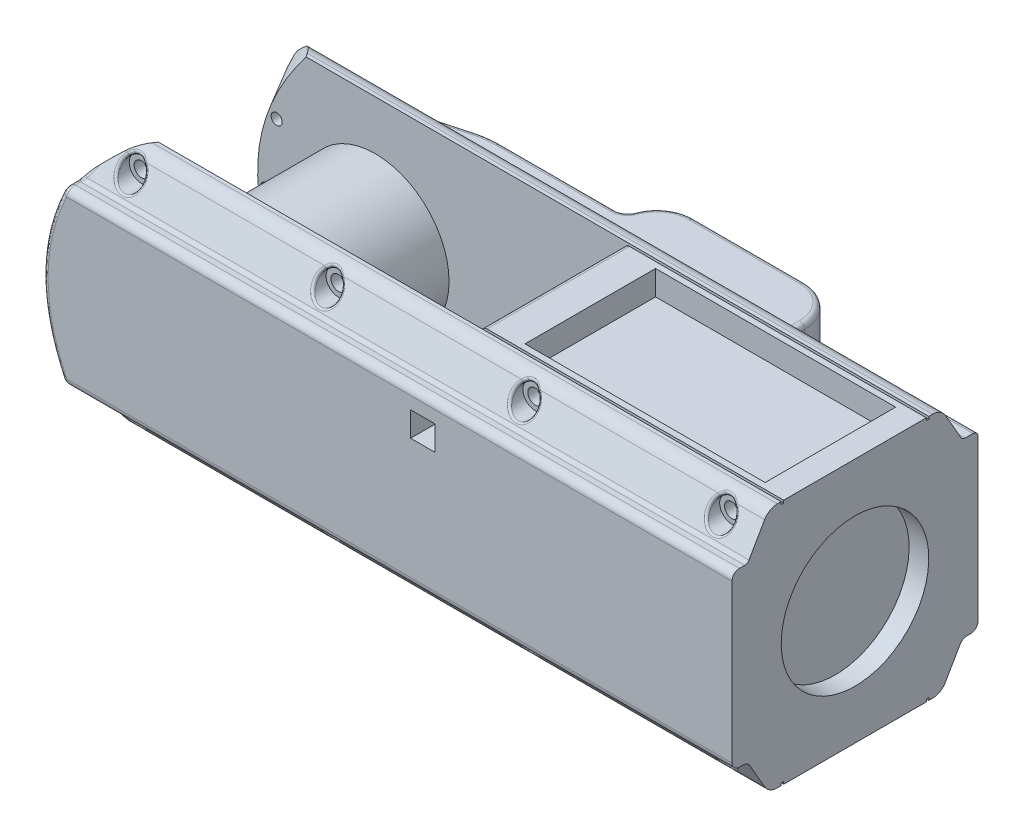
SolidWorks part; units mm, degrees
ref_plane "Płaszczyzna przednia" through (0, 0, 0) normal (0, 0, 1) x (1, 0, 0)
ref_plane "Płaszczyzna górna" through (0, 0, 0) normal (0, 1, 0) x (1, 0, 0)
ref_plane "Płaszczyzna prawa" through (0, 0, 0) normal (1, 0, 0) x (0, 0, -1)
sketch "Szkic1" plane through (0, 0, 0) normal (0, 0, 1) x (1, 0, 0)
  line L1 (-140, 50) -> (140, 50)
  line L2 (-140, 50) -> (-140, -50)
  line L3 (-140, -50) -> (140, -50)
  line L4 (140, 50) -> (140, -50)
  line L5 (-140, 50) -> (140, -50) construction
  line L6 (-140, -50) -> (140, 50) construction
  point P0 (0, 0)
  dimension "D1" = 100
  dimension "D2" = 280
extrude "Dodanie-wyciągnięcie1" add sketch "Szkic1" along normal blind 100
sketch "Szkic2" plane through (140, 0, 0) normal (1, 0, 0) x (0, 0, -1)
  line L0 (-100, 50) -> (0, -50) construction
  circle A0 centre (-50, 0) radius 30
extrude "Wytnij-wyciągnięcie1" cut sketch "Szkic2" against normal blind 8
sketch "Szkic4" plane through (0, 0, 0) normal (0, 0, -1) x (-1, 0, 0)
  line L0 (-140, 50) -> (140, 50) construction
  line L1 (140, 50) -> (140, -50) construction
  line L2 (140, -50) -> (-140, -50) construction
  line L3 (122, 50) -> (140, 50)
  line L4 (140, 50) -> (140, -50)
  line L5 (140, -50) -> (122, -50)
  spline S0 degree 2 poles (122, 50) (158, 0) (122, -50) knots 0 0 0 1 1 1
  dimension "D1" = 18
  dimension "D2" = 18
extrude "Wytnij-wyciągnięcie2" cut sketch "Szkic4" against normal up to next contours S0 L4 M4 | S0 M3 M2
sketch "Szkic5" plane through (0, 50, 0) normal (0, 1, 0) x (1, 0, 0)
  line L0 (-122, -100) -> (-122, 0) construction
  line L1 (-261.3904, -80) -> (17.3904, -80)
  line L2 (-261.3904, -80) -> (-261.3904, -20)
  line L3 (-261.3904, -20) -> (17.3904, -20)
  line L4 (17.3904, -80) -> (17.3904, -20)
  line L5 (-261.3904, -80) -> (17.3904, -20) construction
  line L6 (-261.3904, -20) -> (17.3904, -80) construction
  point P0 (-122, -50)
  dimension "D1" = 60
extrude "Wytnij-wyciągnięcie3" cut sketch "Szkic5" against normal up to next
sketch "Szkic7" plane through (140, 0, 0) normal (1, 0, 0) x (0, 0, -1)
  line L1 (0, 50) -> (-15, 50)
  line L2 (0, 50) -> (0, 35)
  line L3 (0, 35) -> (-15, 35)
  line L4 (-15, 50) -> (-15, 35)
  line L5 (0, 50) -> (-15, 35) construction
  line L6 (0, 35) -> (-15, 50) construction
  point P4 (-7.5, 42.5)
  dimension "D1" = 15
  dimension "D2" = 15
extrude "Wytnij-wyciągnięcie4" cut sketch "Szkic7" against normal up to next
chamfer "Sfazowanie1" distance 15 angle 30 1 edges at (4.41, 35, 15)
fillet "Zaokrąglenie1" radius 2 2 edges at (4.41, 35, 6.3397)
fillet "Zaokrąglenie2" radius 6 1 edges
ref_plane "Płaszczyzna1" through (0, 0, 50) normal (0, 0, 1) x (1, 0, 0)
mirror "Lustro1" about plane through (0, 0, 50) normal (0, 0, 1) of "Wytnij-wyciągnięcie4", "Sfazowanie1", "Zaokrąglenie1", "Zaokrąglenie2"
sketch "Szkic8" plane through (140, 0, 0) normal (1, 0, 0) x (0, 0, -1)
  line L1 (0, -50) -> (-15, -50)
  line L2 (0, -50) -> (0, -35)
  line L3 (0, -35) -> (-15, -35)
  line L4 (-15, -50) -> (-15, -35)
  line L5 (0, -50) -> (-15, -35) construction
  line L6 (0, -35) -> (-15, -50) construction
  point P4 (-7.5, -42.5)
  dimension "D1" = 15
  dimension "D2" = 15
extrude "Wytnij-wyciągnięcie5" cut sketch "Szkic8" against normal up to next
chamfer "Sfazowanie2" distance 15 angle 30 1 edges at (4.41, -35, 15)
fillet "Zaokrąglenie4" radius 3 2 edges at (4.41, -35, 6.3397)
fillet "Zaokrąglenie3" radius 6 1 edges
mirror "Lustro5" about plane through (0, 0, 50) normal (0, 0, 1) of "Zaokrąglenie3", "Zaokrąglenie4", "Sfazowanie2", "Wytnij-wyciągnięcie5"
sketch "Szkic9" plane through (0, 0, 80) normal (0, 0, -1) x (-1, 0, 0)
  line L0 (140, 0) -> (85, 0) construction
  circle A0 centre (85, 0) radius 30
  parabola Q0 construction
  dimension "D1" = 55
fillet "Zaokrąglenie5" radius 3 1 edges
fillet "Zaokrąglenie6" radius 3 1 edges
extrude "Dodanie-wyciągnięcie2" add sketch "Szkic9" along normal up to next contours A0
sketch "Szkic10" plane through (0, 0, 0) normal (0, 0, -1) x (-1, 0, 0)
  line L1 (-59.5151, 27.5) -> (115.4849, 27.5)
  line L2 (-59.5151, 27.5) -> (-59.5151, -27.5)
  line L3 (-59.5151, -27.5) -> (115.4849, -27.5)
  line L4 (115.4849, 27.5) -> (115.4849, -27.5)
  line L5 (-59.5151, 27.5) -> (115.4849, -27.5) construction
  line L6 (-59.5151, -27.5) -> (115.4849, 27.5) construction
  point P0 (27.9849, 0)
  dimension "D1" = 175
  dimension "D2" = 55
  dimension "D3" = 0
extrude "Dodanie-wyciągnięcie3" add sketch "Szkic10" along normal blind 12
chamfer "Sfazowanie3" distance 12 angle 75 1 edges at (-115.4849, 0, -12)
sketch "Szkic11" plane through (0, 0, -12) normal (0, 0, -1) x (-1, 0, 0)
  line L0 (-59.5151, -27.5) -> (70.7003, -27.5) construction
  line L1 (-59.5151, 27.5) -> (15.4849, 27.5)
  line L2 (-59.5151, 27.5) -> (-59.5151, -27.5)
  line L3 (-59.5151, -27.5) -> (15.4849, -27.5)
  line L4 (15.4849, 27.5) -> (15.4849, -27.5)
  line L5 (-59.5151, 27.5) -> (15.4849, -27.5) construction
  line L6 (5.5926, 0) -> (70.7003, 27.5) construction
  line L7 (-59.5151, -27.5) -> (15.4849, 27.5) construction
  point P4 (5.5926, 0)
  point P9 (-22.0151, 0)
  dimension "D1" = 75
extrude "Dodanie-wyciągnięcie4" add sketch "Szkic11" along normal blind 13
fillet "Zaokrąglenie10" radius 15 1 edges at (59.5151, 0, -25)
fillet "Zaokrąglenie11" radius 15 1 edges at (-15.4849, 0, -25)
fillet "Zaokrąglenie12" radius 5 1 edges
fillet "Zaokrąglenie13" radius 35 1 edges at (-70.7003, 0, -12)
sketch "Szkic12" plane through (0, 50, 0) normal (0, 1, 0) x (1, 0, 0)
  line L0 (-122, -81.5359) -> (140, -81.5359) construction
  line L1 (130, -76.5359) -> (32.3904, -76.5359)
  line L2 (130, -76.5359) -> (130, -23.4641)
  line L3 (130, -23.4641) -> (32.3904, -23.4641)
  line L4 (32.3904, -76.5359) -> (32.3904, -23.4641)
  line L5 (130, -76.5359) -> (32.3904, -23.4641) construction
  line L6 (130, -23.4641) -> (32.3904, -76.5359) construction
  line L7 (140, -18.4641) -> (-122, -18.4641) construction
  line L8 (140, -81.5359) -> (140, -18.4641) construction
  line L9 (17.3904, -80) -> (17.3904, -20) construction
  point P4 (81.1952, -50)
  dimension "D1" = 5
  dimension "D2" = 5
  dimension "D3" = 10
  dimension "D4" = 15
  dimension "D5" = 53.0718
extrude "Wytnij-wyciągnięcie6" cut sketch "Szkic12" against normal blind 10
hole_wizard "Pogłębienie walcowe pod M4 Śrubę z łbem stożkowym ściętym1" positions "Szkic 3D2" profile "Szkic13" counterbore size "M4" standard "ISO"
sketch3d "Szkic 3D2"
  point P0 (-125.0722, 22.1469, 0)
  point P2 (-129.4188, -0.967, 0)
sketch "Szkic13" plane through (-125.0722, 22.1469, 0) normal (1, 0, 0) x (0, 1, 0)
  line L0 (0, 0) -> (0, 20)
  line L1 (0, 20) -> (2.25, 20)
  line L3 (2.25, 20) -> (2.25, 3.1)
  line L4 (2.25, 3.1) -> (4.5, 3.1)
  line L5 (4.5, 3.1) -> (4.5, 0)
  line L7 (4.5, 0) -> (0, 0)
  line L11 (0, -6.35) -> (0, 107.95) construction
  dimension "Średnica otworu na wylot" = 4.5
  dimension "Głębokość otworu na wylot" = 20
  dimension "Średnica pogłębienia walcowego" = 9
  dimension "Głębokość pogłębienia walcowego" = 3.1
hole_wizard "Pogłębienie walcowe pod M4 Śrubę z łbem stożkowym ściętym2" positions "Szkic 3D3" profile "Szkic14" counterbore size "M4" standard "ISO"
sketch3d "Szkic 3D3"
  point P0 (-129.3022, -4.5978, 0)
sketch "Szkic14" plane through (-129.3022, -4.5978, 0) normal (1, 0, 0) x (0, 1, 0)
  line L0 (0, 0) -> (0, 20)
  line L1 (0, 20) -> (2.25, 20)
  line L3 (2.25, 20) -> (2.25, 3.1)
  line L4 (2.25, 3.1) -> (4.5, 3.1)
  line L5 (4.5, 3.1) -> (4.5, 0)
  line L7 (4.5, 0) -> (0, 0)
  line L11 (0, -6.35) -> (0, 107.95) construction
  dimension "Średnica otworu na wylot" = 4.5
  dimension "Głębokość otworu na wylot" = 20
  dimension "Średnica pogłębienia walcowego" = 9
  dimension "Głębokość pogłębienia walcowego" = 3.1
chamfer "Sfazowanie4" distance 13 angle 29 2 edges
sketch "Szkic15" plane through (0, 50, 0) normal (0, 1, 0) x (1, 0, 0)
  line L0 (140, -81.5359) -> (140, -18.4641) construction
  line L1 (17.3904, -20) -> (140, -20)
  line L2 (17.3904, -20) -> (17.3904, -21)
  line L3 (17.3904, -21) -> (140, -21)
  line L4 (140, -20) -> (140, -21)
  line L5 (17.3904, -20) -> (140, -21) construction
  line L6 (17.3904, -21) -> (140, -20) construction
  line L8 (17.3904, -80) -> (140, -80)
  line L9 (17.3904, -80) -> (17.3904, -79)
  line L10 (17.3904, -79) -> (140, -79)
  line L11 (140, -80) -> (140, -79)
  line L12 (17.3904, -80) -> (140, -79) construction
  line L13 (17.3904, -79) -> (140, -80) construction
  point P4 (78.6952, -20.5)
  point P12 (78.6952, -79.5)
  dimension "D1" = 1
  dimension "D2" = 1
extrude "Wytnij-wyciągnięcie7" cut sketch "Szkic15" against normal blind 1
sketch "Szkic16" plane through (0, -50, 0) normal (0, -1, 0) x (1, 0, 0)
  line L0 (140, 81.5359) -> (140, 18.4641) construction
  line L1 (17.3904, 80) -> (140, 80)
  line L2 (17.3904, 80) -> (17.3904, 79)
  line L3 (17.3904, 79) -> (140, 79)
  line L4 (140, 80) -> (140, 79)
  line L5 (17.3904, 80) -> (140, 79) construction
  line L6 (17.3904, 79) -> (140, 80) construction
  line L8 (17.3904, 20) -> (140, 20)
  line L9 (17.3904, 20) -> (17.3904, 21)
  line L10 (17.3904, 21) -> (140, 21)
  line L11 (140, 20) -> (140, 21)
  line L12 (17.3904, 20) -> (140, 21) construction
  line L13 (17.3904, 21) -> (140, 20) construction
  point P4 (78.6952, 79.5)
  point P12 (78.6952, 20.5)
  dimension "D1" = 1
  dimension "D2" = 1
extrude "Wytnij-wyciągnięcie8" cut sketch "Szkic16" against normal blind 1
ref_plane "Płaszczyzna2" through (0, 0, 4) normal (0, 0, 1) x (1, 0, 0)
ref_plane "Płaszczyzna3" through (0, 0, 96) normal (0, 0, 1) x (1, 0, 0)
sketch "Szkic17" plane through (0, 0, 4) normal (0, 0, 1) x (1, 0, 0)
  line L0 (140, 50) -> (-114.1696, 50) construction
  line L1 (140, 36) -> (140, 47) construction
  circle A0 centre (125, 42) radius 3
  dimension "D1" = 8
  dimension "D2" = 15
extrude "Wytnij-wyciągnięcie9" cut sketch "Szkic17" along normal blind 15
sketch "Szkic18" plane through (0, 0, 96) normal (0, 0, 1) x (1, 0, 0)
  circle A0 centre (125, 42) radius 5
extrude "Wytnij-wyciągnięcie10" cut sketch "Szkic18" against normal blind 11
pattern_linear "Szyk liniowy1" count 4 spacing 80 along (-1, 0, 0) of "Wytnij-wyciągnięcie10"
pattern_linear "Szyk liniowy2" count 4 spacing 80 along (-1, 0, 0) of "Wytnij-wyciągnięcie9"
mirror "Lustro6" about plane through (0, 0, 50) normal (0, 0, 1) of "Szyk liniowy2", "Wytnij-wyciągnięcie9"
mirror "Lustro7" about plane through (0, 0, 50) normal (0, 0, 1) of "Szyk liniowy1", "Wytnij-wyciągnięcie10"
mirror "Lustro8" about plane through (0, 0, 0) normal (0, 1, 0) of "Szyk liniowy2", "Lustro7", "Wytnij-wyciągnięcie9", "Wytnij-wyciągnięcie10", "Szyk liniowy1"
mirror "Lustro9" about plane through (0, 0, 0) normal (0, 1, 0) of "Lustro6", "Lustro8"
fillet "Zaokrąglenie14" radius 2 38 edges at (-27.9849, -27.5, 0) (-115.4849, 0, 0) (59.5151, 0, 0) (-130.9963, 35.3626, 93.6666) (-131.6609, 34.0324, 99.2067) (-130.8095, -35.7275, 93.4338) (-131.4536, -34.4529, 98.7272) (-130.9343, 35.4842, 6.4898) (-131.3626, 34.6357, 0.8491) (-131.1081, -35.1423, 5.5207) (-131.6609, -34.0324, 0.7933) (59.5151, -27.5, -5) (55.1217, -27.5, -20.6066) (-95.318, -27.5, -5.4037) (-70.6609, -27.5, -11.7006) (-16.5034, -27.5, -12.8921) (-95.318, 27.5, -5.4037) (-70.6609, 27.5, -11.7006) (-16.5034, 27.5, -12.8921) (59.5151, 27.5, -5) (55.1217, 27.5, -20.6066) (17.3904, -50, 50) (17.3904, 50, 50) (-27.9849, 27.5, 0) (21.9481, -27.5, -25) (21.9481, 27.5, -25)
sketch "Szkic19" plane through (0, 0, 100) normal (0, 0, 1) x (1, 0, 0)
  line L0 (140, 32) -> (-130.4199, 32) construction
  line L1 (9.3796, 27) -> (19.3796, 27)
  line L2 (9.3796, 27) -> (9.3796, 17)
  line L3 (9.3796, 17) -> (19.3796, 17)
  line L4 (19.3796, 27) -> (19.3796, 17)
  line L5 (9.3796, 27) -> (19.3796, 17) construction
  line L6 (9.3796, 17) -> (19.3796, 27) construction
  point P4 (14.3796, 22)
  dimension "D1" = 10
  dimension "D2" = 10
  dimension "D3" = 10
extrude "Wytnij-wyciągnięcie11" cut sketch "Szkic19" against normal blind 10
fillet "Zaokrąglenie15" radius 1 16 edges at (125, 37, 92.5056) (45, 37, 92.5056) (-35, 37, 92.5056) (-115, 37, 92.5056) (-115, -37, 92.5056) (-35, -37, 92.5056) (45, -37, 92.5056) (125, -37, 92.5056) (-115, -37, 7.4944) (45, -37, 7.4944) (-35, -37, 7.4944) (125, -37, 7.4944) (125, 37, 7.4944) (-115, 37, 7.4944) (-35, 37, 7.4944) (45, 37, 7.4944)
fillet "Zaokrąglenie16" radius 1 2 edges at (-133.8022, -4.5978, 0) (-129.5722, 22.1469, 0)
